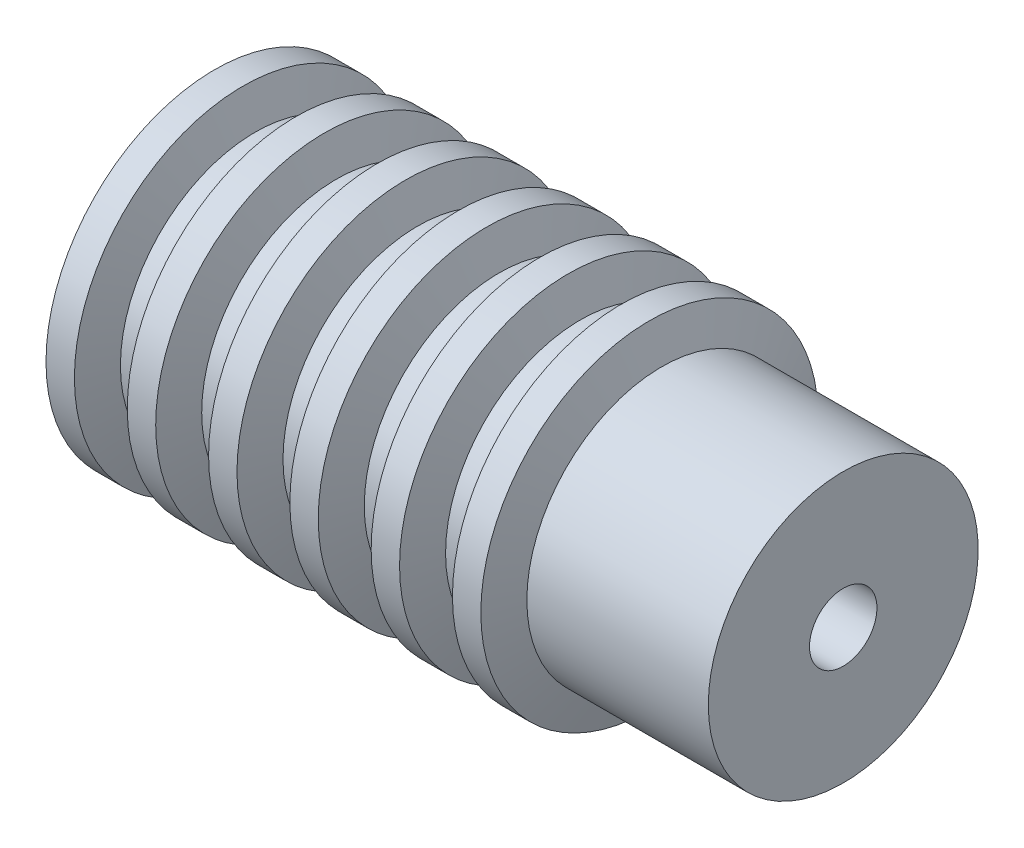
SolidWorks part; units mm, degrees
ref_plane "Front" through (0, 0, 0) normal (0, 0, 1) x (1, 0, 0)
ref_plane "Top" through (0, 0, 0) normal (0, 1, 0) x (1, 0, 0)
ref_plane "Right" through (0, 0, 0) normal (1, 0, 0) x (0, 0, -1)
sketch "Sketch1" plane through (0, 0, 0) normal (0, 0, 1) x (1, 0, 0)
  line L0 (0, 0) -> (19, 0)
  line L1 (19, 1) -> (19, 4)
  line L2 (19, 4) -> (14, 4)
  line L3 (10.846, 5) -> (10.004, 5)
  line L4 (13.256, 5) -> (12.414, 5)
  line L5 (0, 4) -> (0, 1)
  line L6 (1.57, 4) -> (2.41, 4)
  line L7 (0, 4) -> (0.364, 5)
  line L8 (0, 1) -> (19, 1)
  line L9 (2.41, 4) -> (2.774, 5)
  line L10 (1.57, 4) -> (1.206, 5)
  line L11 (3.98, 4) -> (3.616, 5)
  line L12 (4.82, 4) -> (5.184, 5)
  line L13 (6.39, 4) -> (6.026, 5)
  line L14 (7.23, 4) -> (7.594, 5)
  line L15 (8.8, 4) -> (8.436, 5)
  line L16 (9.64, 4) -> (10.004, 5)
  line L17 (11.21, 4) -> (10.846, 5)
  line L18 (12.05, 4) -> (12.414, 5)
  line L19 (13.62, 4) -> (13.256, 5)
  line L20 (8.436, 5) -> (7.594, 5)
  line L21 (6.026, 5) -> (5.184, 5)
  line L22 (3.616, 5) -> (2.774, 5)
  line L23 (1.206, 5) -> (0.364, 5)
  line L24 (3.98, 4) -> (4.82, 4)
  line L25 (6.39, 4) -> (7.23, 4)
  line L26 (8.8, 4) -> (9.64, 4)
  line L27 (11.21, 4) -> (12.05, 4)
  line L28 (13.62, 4) -> (14, 4)
revolve "Revolve1" add sketch "Sketch1" angle 360 about L0
